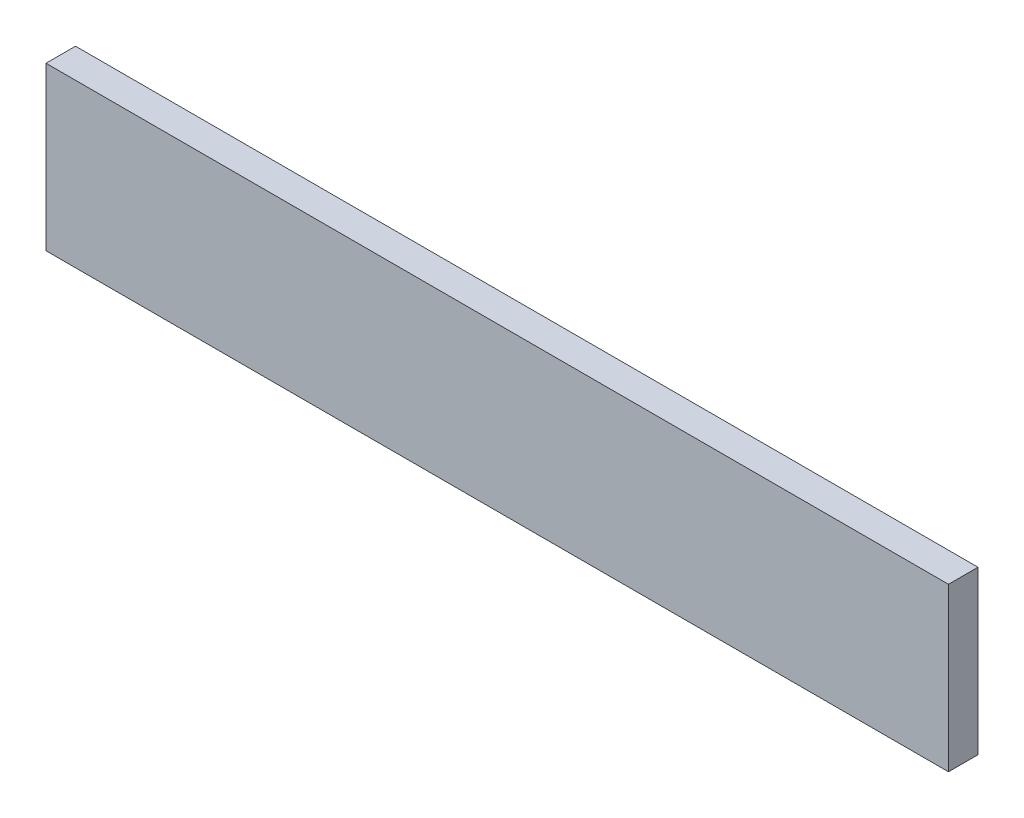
SolidWorks part; units mm, degrees
ref_plane "Plan de face" through (0, 0, 0) normal (0, 0, 1) x (1, 0, 0)
ref_plane "Plan de dessus" through (0, 0, 0) normal (0, 1, 0) x (1, 0, 0)
ref_plane "Plan de droite" through (0, 0, 0) normal (1, 0, 0) x (0, 0, -1)
sketch "Esquisse1" plane through (0, 0, 0) normal (0, 0, 1) x (1, 0, 0)
  line L0 (0, 0) -> (423.1662, 0) construction
  line L1 (305.6235, 0) -> (0, 0)
  line L2 (305.6235, 0) -> (305.6235, -55)
  line L3 (305.6235, -55) -> (0, -55)
  line L4 (0, 0) -> (0, -55)
  dimension "D1" = 305.6235
extrude "Extrusion1" add sketch "Esquisse1" against normal blind 10
